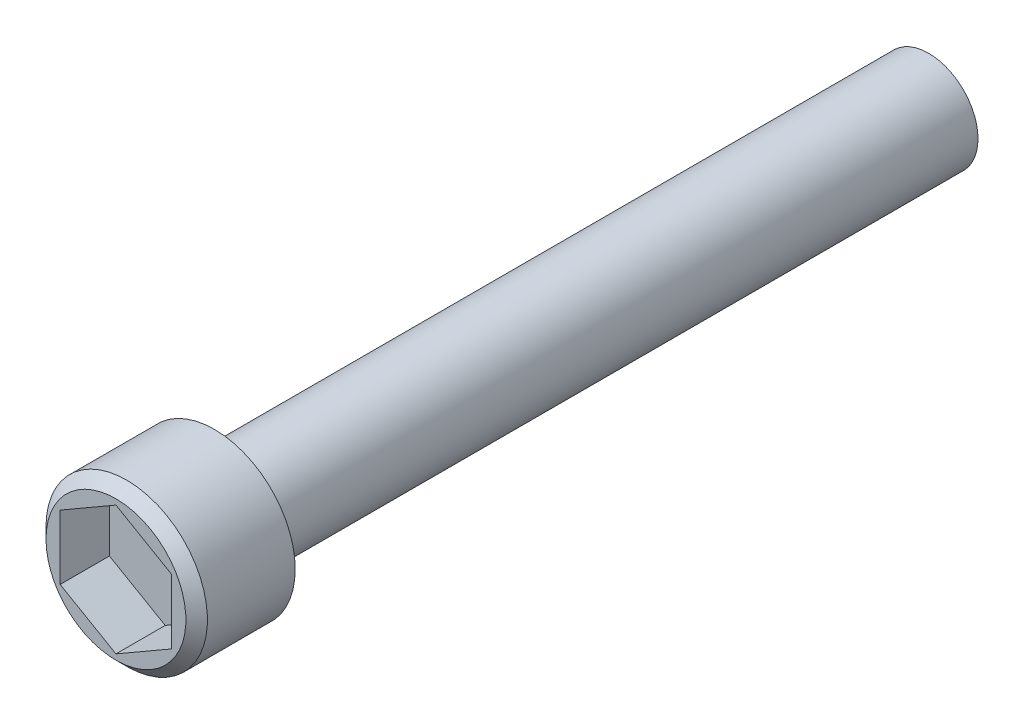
SolidWorks part; units mm, degrees
ref_plane "Plane1" through (0, 0, 0) normal (0, 0, 1) x (1, 0, 0)
ref_plane "Plane2" through (0, 0, 0) normal (0, 1, 0) x (1, 0, 0)
ref_plane "Plane3" through (0, 0, 0) normal (1, 0, 0) x (0, 0, -1)
sketch "Sketch1" plane through (0, 0, 0) normal (0, 0, 1) x (1, 0, 0)
  circle A0 centre (0, 0) radius 1.7526
extrude "Shank" add sketch "Sketch1" along normal blind 25.4
sketch "Sketch2" plane through (0, 0, 25.4) normal (0, 0, 1) x (1, 0, 0)
  circle A0 centre (0, 0) radius 2.8702
  dimension "CapDia" = 5.7404
extrude "Cap" add sketch "Sketch2" along normal blind 3.5052
fillet "Fillet1" radius 0.254 1 edges at (1.7526, 0, 25.4)
sketch "Sketch3" plane through (4.8749, 0.9257, 28.9052) normal (0, 0, 1) x (1, 0, 0)
  line L0 (-6.8592, 0.22) -> (-2.8905, 0.22) construction
  line L1 (-6.8592, 0.22) -> (-6.8592, -2.0714) construction
  line L2 (-2.8905, -2.0714) -> (-6.8592, -2.0714) construction
  line L3 (-2.8905, -2.0714) -> (-2.8905, 0.22) construction
  line L4 (-4.8749, 1.3657) -> (-2.8905, 0.22)
  line L5 (-2.8905, 0.22) -> (-2.8905, -2.0714)
  line L6 (-4.8749, -97.1111) -> (-4.8749, 86.7895) construction
  line L7 (-95.5828, -0.9257) -> (80.0294, -0.9257) construction
  line L8 (-6.8592, 0.22) -> (-6.8592, -2.0714)
  line L9 (-4.8749, 1.3657) -> (-6.8592, 0.22)
  line L10 (-4.8749, -3.2171) -> (-2.8905, -2.0714)
  line L11 (-4.8749, -3.2171) -> (-6.8592, -2.0714)
  circle A0 centre (-4.8749, -0.9257) radius 2.2914 construction
  point P14 (-2.8905, -0.9257)
  point P15 (-6.8592, -0.9257)
extrude "HexCut" cut sketch "Sketch3" against normal blind 1.7526
chamfer "Chamfer1" distance 0.3827 angle 45 1 edges at (2.8702, 0, 28.9052)
equation "\"HexDepth@HexCut\" = .5 * \"ThreadDia@Cap\""
equation "\"Cut@Chamfer1\" =  ( 1 / 15 )  * \"CapDia@Sketch2\""
